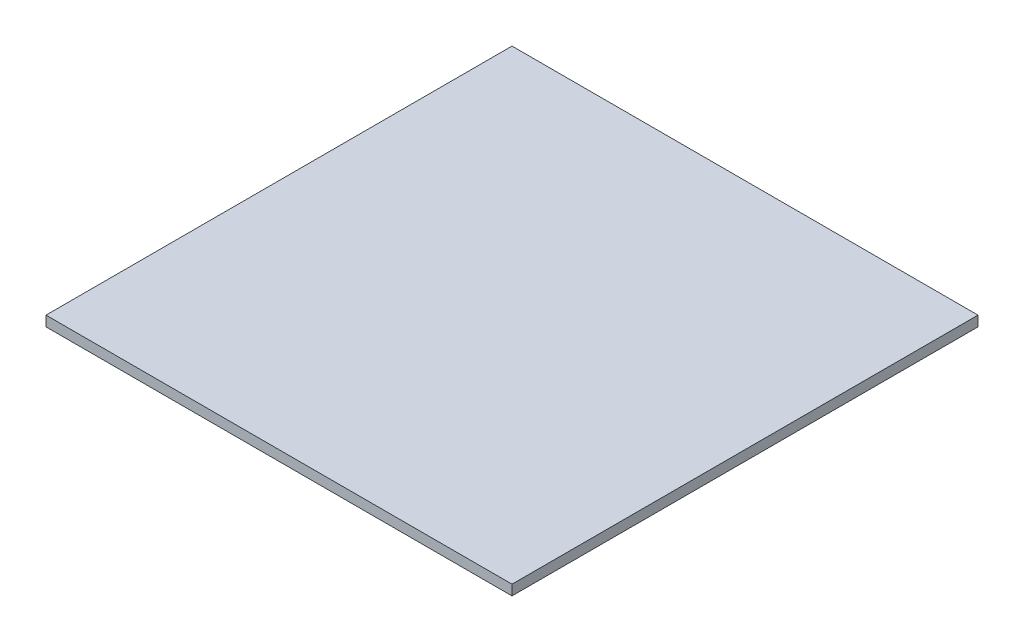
SolidWorks part; units mm, degrees
ref_plane "Front Plane" through (0, 0, 0) normal (0, 0, 1) x (1, 0, 0)
ref_plane "Top Plane" through (0, 0, 0) normal (0, 1, 0) x (1, 0, 0)
ref_plane "Right Plane" through (0, 0, 0) normal (1, 0, 0) x (0, 0, -1)
sketch "Sketch1" plane through (0, 0, 0) normal (0, 1, 0) x (1, 0, 0)
  line L1 (114.3, -114.3) -> (-114.3, -114.3)
  line L2 (114.3, -114.3) -> (114.3, 114.3)
  line L3 (114.3, 114.3) -> (-114.3, 114.3)
  line L4 (-114.3, -114.3) -> (-114.3, 114.3)
  line L5 (114.3, -114.3) -> (-114.3, 114.3) construction
  line L6 (114.3, 114.3) -> (-114.3, -114.3) construction
  point P0 (0, 0)
  dimension "D1" = 228.6
  dimension "D2" = 228.6
extrude "Boss-Extrude1" add sketch "Sketch1" along normal blind 5
